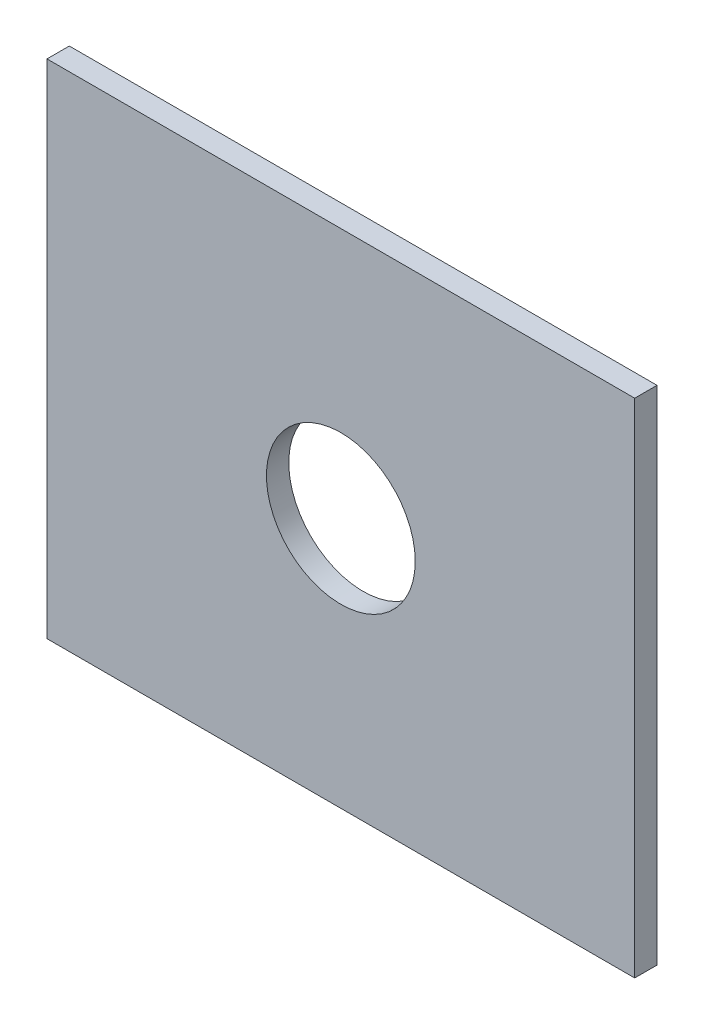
SolidWorks part; units mm, degrees
ref_plane "Plan de face" through (0, 0, 0) normal (0, 0, 1) x (1, 0, 0)
ref_plane "Plan de dessus" through (0, 0, 0) normal (0, 1, 0) x (1, 0, 0)
ref_plane "Plan de droite" through (0, 0, 0) normal (1, 0, 0) x (0, 0, -1)
sketch "Esquisse1" plane through (0, 0, 0) normal (0, 0, 1) x (1, 0, 0)
  line L1 (-75.1548, 62.5606) -> (82.8452, 62.5606)
  line L2 (-75.1548, 62.5606) -> (-75.1548, -72.4394)
  line L3 (-75.1548, -72.4394) -> (82.8452, -72.4394)
  line L4 (82.8452, 62.5606) -> (82.8452, -72.4394)
  circle A0 centre (3.8452, -4.9394) radius 20
  dimension "D5" = 40
  dimension "D1" = 158
  dimension "D2" = 135
  dimension "D3" = 79
  dimension "D4" = 67.5
extrude "Boss.-Extru.1" add sketch "Esquisse1" along normal blind 6
